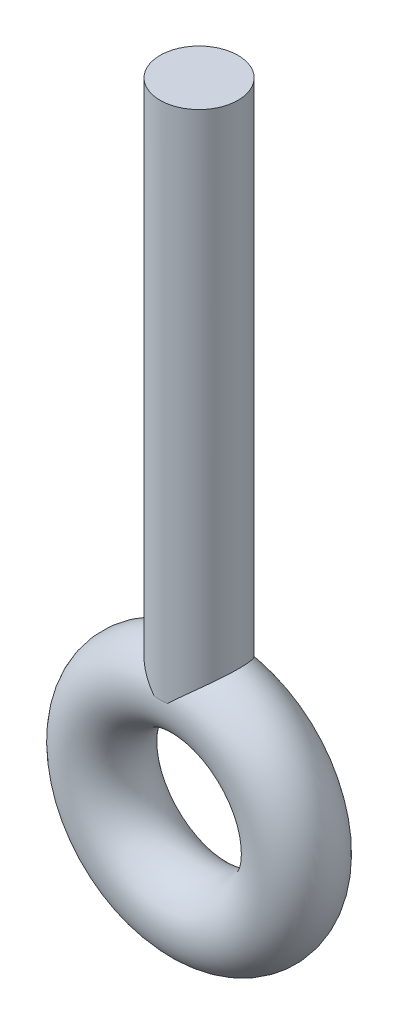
SolidWorks part; units mm, degrees
ref_plane "Front Plane" through (0, 0, 0) normal (0, 0, 1) x (1, 0, 0)
ref_plane "Top Plane" through (0, 0, 0) normal (0, 1, 0) x (1, 0, 0)
ref_plane "Right Plane" through (0, 0, 0) normal (1, 0, 0) x (0, 0, -1)
sketch "Sketch1" plane through (0, 0, 0) normal (0, 1, 0) x (1, 0, 0)
  line L0 (-55, 0) -> (55, 0) construction
  line L1 (0, 26.0951) -> (0, -29.4115) construction
  line L2 (0, -55) -> (0, 55) construction
  circle A0 centre (-7.5, 0) radius 3
revolve "Revolve1" add sketch "Sketch1" angle 360 about L1
ref_plane "Plane1" through (0, 8, 0) normal (0, 1, 0) x (1, 0, 0)
sketch "Sketch2" plane through (0, 8, 0) normal (0, 1, 0) x (1, 0, 0)
  circle A0 centre (0, 0) radius 3
extrude "Boss-Extrude1" add sketch "Sketch2" along normal blind 40
